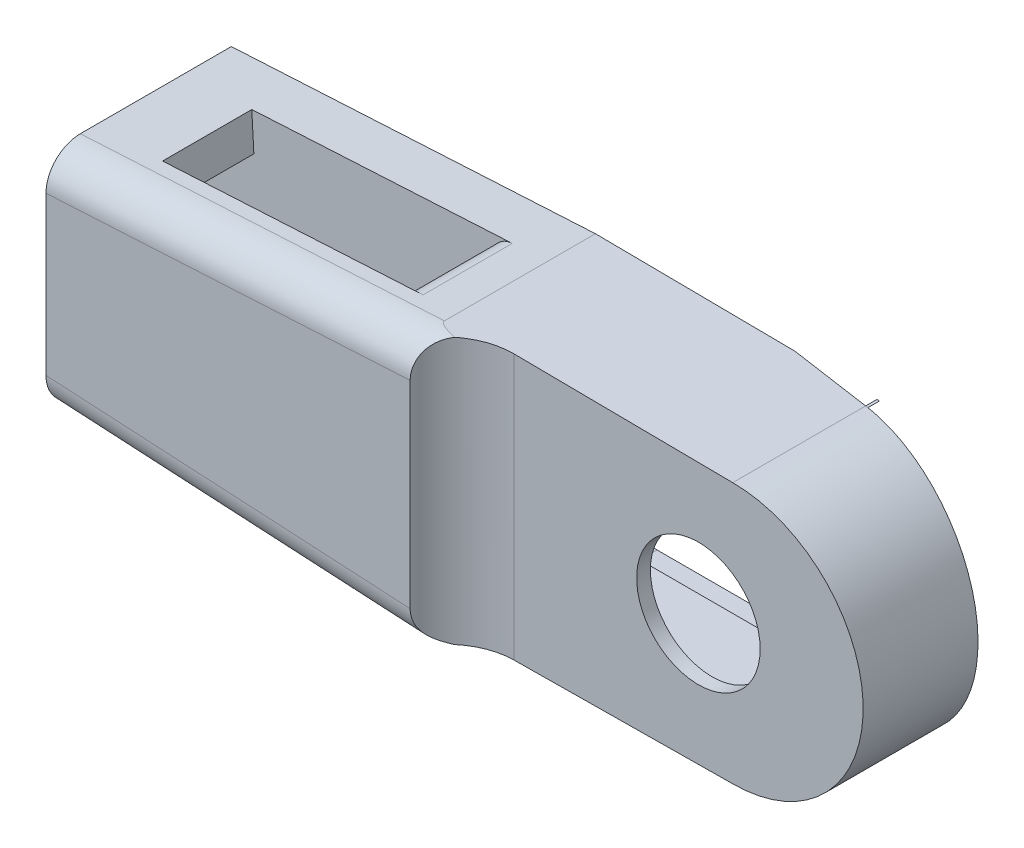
SolidWorks part; units mm, degrees
ref_plane "Front Plane" through (0, 0, 0) normal (0, 0, 1) x (1, 0, 0)
ref_plane "Top Plane" through (0, 0, 0) normal (0, 1, 0) x (1, 0, 0)
ref_plane "Right Plane" through (0, 0, 0) normal (1, 0, 0) x (0, 0, -1)
sketch "Sketch1" plane through (0, 0, 0) normal (0, 0, 1) x (1, 0, 0)
  line L0 (-903.2402, 0) -> (44258.7688, 0) construction
  line L1 (0, -903.2402) -> (0, -19.41) construction
  line L3 (0, 19.41) -> (41, 19)
  line L4 (0, -19.41) -> (41, -19)
  line L5 (-53.05, 16.5) -> (-53.05, -16.5)
  line L6 (-53.05, 16.5) -> (0, 19.41)
  line L7 (-53.05, -16.5) -> (0, -19.41)
  line L8 (0, 19.41) -> (0, 44258.7688) construction
  arc A0 (41, -19) -> (41, 19) centre (41, 0) ccw
  circle A1 centre (36, 0) radius 9
  dimension "D1" = 38
  dimension "D7" = 18
  dimension "D2" = 38.82
  dimension "D3" = 41
  dimension "D4" = 33
  dimension "D5" = 53.05
  dimension "D6" = 5
extrude "Boss-Extrude1" add sketch "Sketch1" against normal blind 27
sketch "Sketch2" plane through (0, 0, 0) normal (0, 0, 1) x (1, 0, 0)
  line L0 (41, 19) -> (0, 19.41)
  line L1 (41, 19) -> (0, 19.41) construction
  line L2 (0, 19.41) -> (0, -19.41)
  line L3 (0, -19.41) -> (41, -19)
  arc A0 (41, -19) -> (41, 19) centre (41, 0) ccw
  dimension "D1" = 41
  dimension "D2" = 38.82
extrude "Cut-Extrude1" cut sketch "Sketch2" against normal blind 6
fillet "Fillet1" radius 10 1 edges at (0, 0, -6)
sketch "Sketch5" plane through (-1.0615, 19.3518, 0) normal (-0.0548, 0.9985, 0) x (0.9985, 0.0548, 0)
  line L0 (-52.0666, 27) -> (-52.0666, 0) construction
  line L1 (-42.0666, 7) -> (-7.0666, 7)
  line L2 (-42.0666, 7) -> (-42.0666, 20)
  line L3 (-42.0666, 20) -> (-7.0666, 20)
  line L4 (-7.0666, 7) -> (-7.0666, 20)
  line L5 (-1052.0666, 13.5) -> (48947.9334, 13.5) construction
  point P9 (-52.0666, 13.5)
  dimension "D1" = 10
  dimension "D2" = 35
  dimension "D3" = 13
extrude "Cut-Extrude5" cut sketch "Sketch5" against normal blind 82
fillet "Fillet2" radius 3 2 edges at (-6.0307, -19.0792, -13.5) (-8.1175, 18.9647, -13.5)
sketch "Sketch6" plane through (-42.0035, -2.3041, 0) normal (0.9985, 0.0548, 0) x (0, 0, -1)
  line L0 (20, 19.3809) -> (7, 19.3809) construction
  line L1 (7, 13.9309) -> (20, 13.9309)
  line L2 (7, 13.9309) -> (7, -9.0691)
  line L3 (7, -9.0691) -> (20, -9.0691)
  line L4 (20, 13.9309) -> (20, -9.0691)
  line L5 (7, -14.8689) -> (7, 19.3809) construction
  dimension "D1" = 13
  dimension "D2" = 23
  dimension "D3" = 5.45
extrude "Cut-Extrude6" cut sketch "Sketch6" against normal blind 8
sketch "Sketch7" plane through (-53.05, 0, 0) normal (-1, 0, 0) x (0, 0, 1)
  line L0 (-27, 16.5) -> (-27, -16.5) construction
  circle A0 centre (-13.4, 0) radius 6.45
  dimension "D1" = 12.9
  dimension "D2" = 13.6
extrude "Cut-Extrude7" cut sketch "Sketch7" against normal blind 8
sketch "Sketch8" plane through (0, 0, -27) normal (0, 0, -1) x (-1, 0, 0)
  line L0 (-40, 0) -> (-9, 0) construction
  line L1 (-40, 16) -> (-9, 16)
  line L2 (-40, -16) -> (-9, -16)
  arc A0 (-40, 16) -> (-40, -16) centre (-40, 0) ccw
  arc A1 (-9, -16) -> (-9, 16) centre (-9, 0) ccw
  point P3 (-24.5, 0)
  point P8 (0, 0)
  point P9 (-24.2435, 0)
  point P10 (0, 0)
  dimension "D1" = 32
  dimension "D2" = 31
  dimension "D3" = 1
extrude "Cut-Extrude8" cut sketch "Sketch8" against normal blind 8
sketch "Sketch10" plane through (0, 0, -19) normal (0, 0, -1) x (-1, 0, 0)
  line L1 (-46.1138, 10.5) -> (-5.1138, 10.5)
  line L2 (-46.1138, 10.5) -> (-46.1138, -10.5)
  line L3 (-46.1138, -10.5) -> (-5.1138, -10.5)
  line L4 (-5.1138, 10.5) -> (-5.1138, -10.5)
  line L5 (-46.1138, 10.5) -> (-5.1138, -10.5) construction
  line L6 (-46.1138, -10.5) -> (-5.1138, 10.5) construction
  point P0 (-25.6138, 0)
  dimension "D1" = 41
  dimension "D2" = 21
extrude "Cut-Extrude9" cut sketch "Sketch10" against normal blind 11
sketch "Sketch11" plane through (0, 0, -19) normal (0, 0, -1) x (-1, 0, 0)
  line L0 (-46.1138, 10.5) -> (-46.1138, -10.5) construction
  line L1 (-46.1138, 10.5) -> (-46.1138, -10.5) construction
  line L2 (-5.1138, -10.5) -> (-5.1138, 10.5) construction
  line L3 (-1005.1138, 0) -> (48994.8862, 0) construction
  line L4 (-5.1138, -10.5) -> (-5.1138, 10.5) construction
  circle A0 centre (-49.5738, 5) radius 1.1
  circle A1 centre (-49.5738, -5) radius 1.1
  circle A2 centre (-1.6538, 5) radius 1.1
  circle A3 centre (-1.6538, -5) radius 1.1
  point P9 (-1.6538, 6.0881)
  point P21 (-5.1138, 0)
  dimension "D1" = 2.2
  dimension "D2" = 10
  dimension "D3" = 10
  dimension "D4" = 3.46
  dimension "D5" = 3.46
  dimension "D6" = 3.46
  dimension "D7" = 3.46
  dimension "D8" = 5
  dimension "D9" = 5
extrude "Cut-Extrude10" cut sketch "Sketch11" against normal blind 8
fillet "Fillet3" radius 5 2 edges at (-26.525, 17.955, 0) (-26.525, -17.955, 0)
sketch "Sketch13" plane through (0.1941, 19.4081, 0) normal (0.01, 1, 0) x (1, -0.01, 0)
  line L0 (28.8714, 27) -> (61.9197, 22.4741)
  line L1 (40.808, 27) -> (-0.1941, 27) construction
  line L2 (61.9197, 22.4741) -> (63.8635, 36.6679)
  line L3 (63.8635, 36.6679) -> (28.8714, 35.5326)
  line L4 (28.8714, 35.5326) -> (28.8714, 27)
extrude "Cut-Extrude15" cut sketch "Sketch13" against normal blind 39
